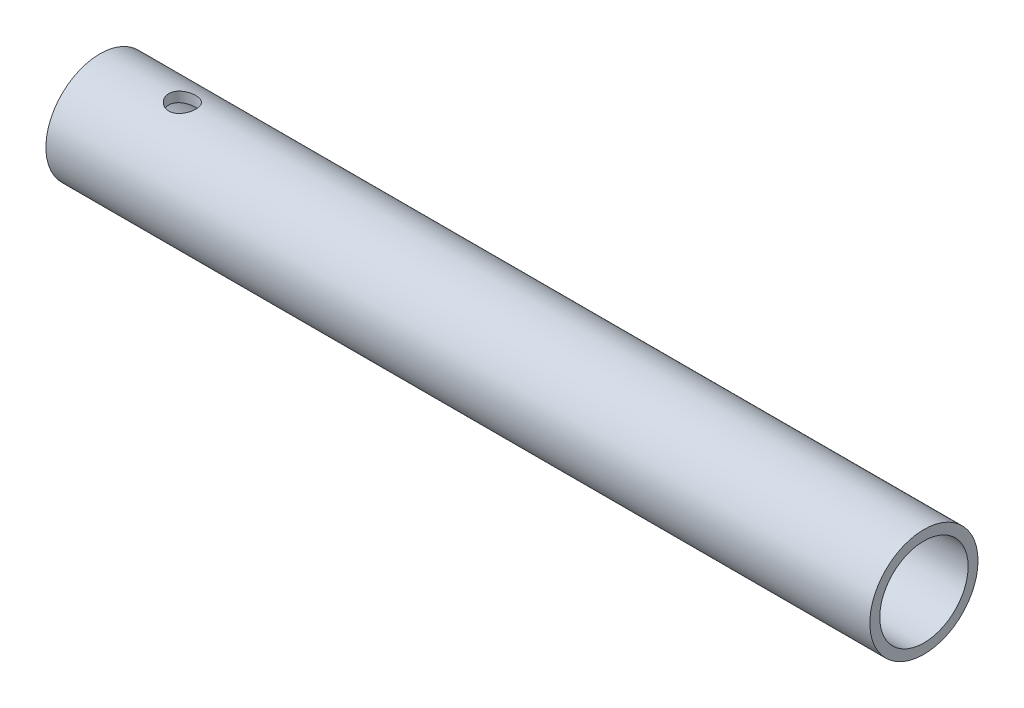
SolidWorks part; units mm, degrees
ref_plane "Front Plane" through (0, 0, 0) normal (0, 0, 1) x (1, 0, 0)
ref_plane "Top Plane" through (0, 0, 0) normal (0, 1, 0) x (1, 0, 0)
ref_plane "Right Plane" through (0, 0, 0) normal (1, 0, 0) x (0, 0, -1)
sketch "Sketch1" plane through (0, 0, 0) normal (1, 0, 0) x (0, 0, -1)
  circle A0 centre (0, 0) radius 16.6687
  circle A2 centre (0, 0) radius 13.6207
  dimension "D1" = 33.3375
  dimension "D2" = 3.048
extrude "Extrude1" add sketch "Sketch1" along normal mid plane 254
sketch "Sketch2" plane through (0, 0, 0) normal (0, 1, 0) x (1, 0, 0)
  line L0 (-164.0812, 0) -> (19.5362, 0) construction
  line L2 (-127, 16.6687) -> (-127, -16.6687) construction
  circle A0 centre (-101.6, 0) radius 4.1656
  dimension "D1" = 8.3312
  dimension "D2" = 25.4
extrude "Extrude2" cut sketch "Sketch2" against normal through all and the other way through all
